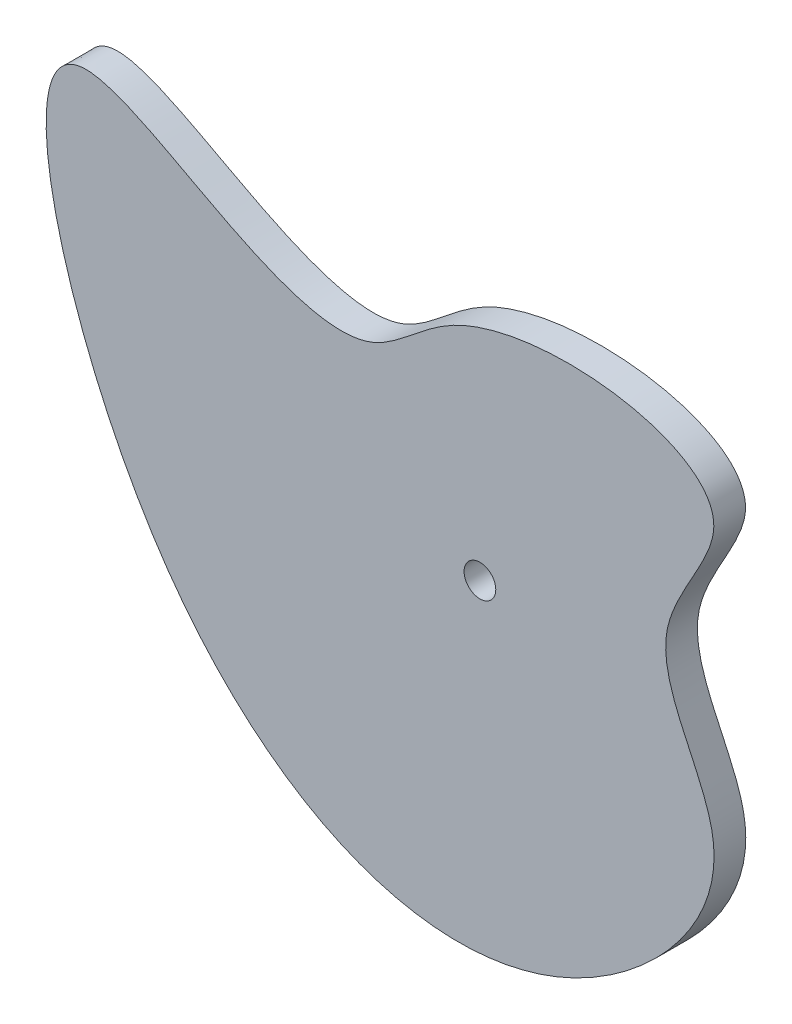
SolidWorks part; units mm, degrees
ref_plane "Front Plane" through (0, 0, 0) normal (0, 0, 1) x (1, 0, 0)
ref_plane "Top Plane" through (0, 0, 0) normal (0, 1, 0) x (1, 0, 0)
ref_plane "Right Plane" through (0, 0, 0) normal (1, 0, 0) x (0, 0, -1)
sketch "Sketch1" plane through (0, 0, 0) normal (0, 0, 1) x (1, 0, 0)
  circle A0 centre (0, 0) radius 1.5875
  spline S0 degree 3 poles (31.7575, 22.0916) (-0.3515, 26.41) (-14.6663, 7.8048) (-52.2353, 41.9016) (-34.973, -26.0988) (5.306, -39.7868) (28.9329, -12.2209) (14.1948, 3.4222) (31.7575, 22.0916) (-0.3515, 26.41) (-14.6663, 7.8048) knots -0.272914 -0.192251 -0.131028 0 0.049568 0.199465 0.394943 0.620577 0.727086 0.807749 0.868972 1 1.049568 1.199465 1.394943 only from (-2.6626, 20.8153) to (-2.6626, 20.8153)
  point P5 (-18.4248, -10.4363)
  point P7 (1.6383, -19.2139)
  point P9 (-31.7006, -14.0557)
  point P11 (-26.1194, 15.2456)
  point P13 (11.4715, -28.6653)
  point P15 (-39.7441, 24.6022)
  dimension "D1" = 3.175
extrude "Boss-Extrude1" add sketch "Sketch1" along normal blind 3.175
